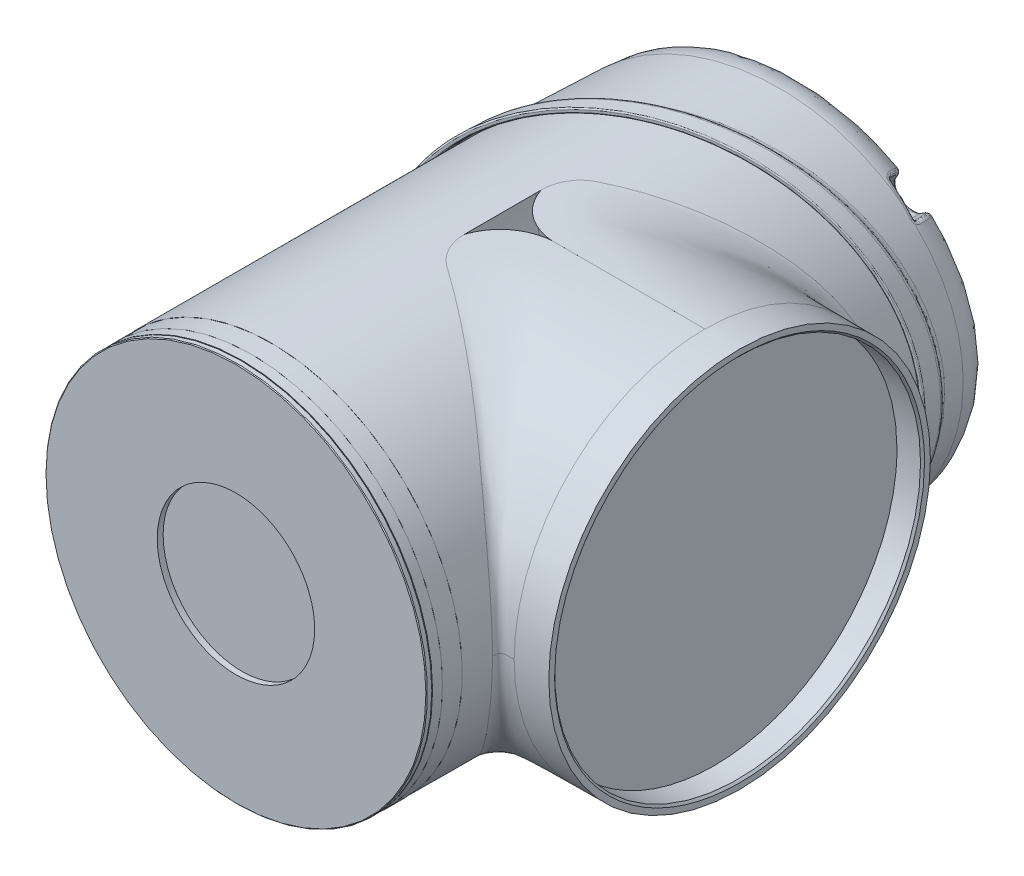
SolidWorks part; units mm, degrees
other "CRJ-20关节-固定部分-1/20关节橡胶环-C-1-solid1"
other "NONE"
ref_plane "前视基准面" through (0, 0, 0) normal (0, 0, 1) x (1, 0, 0)
ref_plane "上视基准面" through (0, 0, 0) normal (0, 1, 0) x (1, 0, 0)
ref_plane "右视基准面" through (0, 0, 0) normal (1, 0, 0) x (0, 0, -1)
imported_body "曲面-输入1"
imported_body "输入1"
imported_body "输入2"
delete or keep bodies "实体-删除/保留 1" type delete bodies bodies 106
